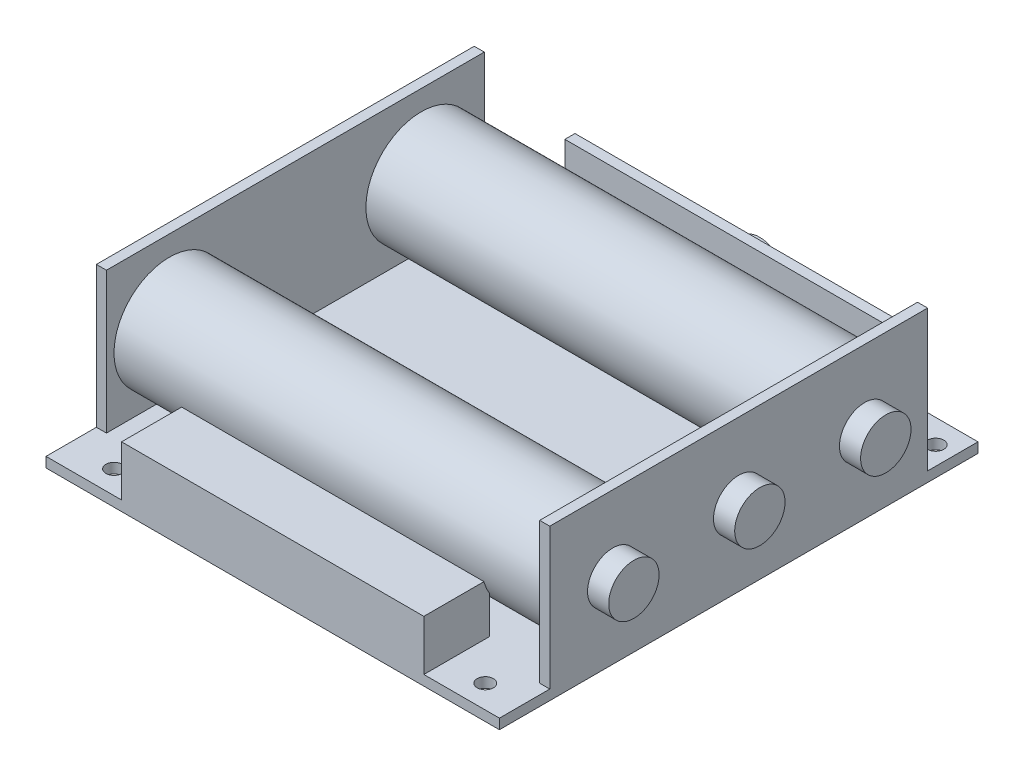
SolidWorks part; units mm, degrees
ref_plane "Front Plane" through (0, 0, 0) normal (0, 0, 1) x (1, 0, 0)
ref_plane "Top Plane" through (0, 0, 0) normal (0, 1, 0) x (1, 0, 0)
ref_plane "Right Plane" through (0, 0, 0) normal (1, 0, 0) x (0, 0, -1)
sketch "Sketch1" plane through (0, 0, 0) normal (0, 1, 0) x (1, 0, 0)
  line L1 (45, 47.5) -> (-45, 47.5)
  line L2 (45, 47.5) -> (45, -47.5)
  line L3 (45, -47.5) -> (-45, -47.5)
  line L4 (-45, 47.5) -> (-45, -47.5)
  line L5 (45, 47.5) -> (-45, -47.5) construction
  line L6 (45, -47.5) -> (-45, 47.5) construction
  point P0 (0, 0)
  dimension "D1" = 90
  dimension "D2" = 95
extrude "Boss-Extrude1" add sketch "Sketch1" along normal blind 2
hole_wizard "Ø3.2 (3.2) Diameter Hole1" positions "Sketch3" profile "Sketch2" hole size "Ø3.2" standard "ISO"
sketch "Sketch3" plane through (0, 0, 0) normal (0, -1, 0) x (-1, 0, 0)
  line L0 (45, 47.5) -> (45, -47.5) construction
  line L2 (45, -47.5) -> (-45, -47.5) construction
  line L3 (-45, -47.5) -> (-45, 47.5) construction
  line L4 (-45, 47.5) -> (45, 47.5) construction
  point P0 (36.1, -42.9)
  point P2 (-37.6, -42.9)
  point P4 (-41.3, 42.8)
  point P6 (38.7, 42.8)
  dimension "D1" = 8.9
  dimension "D2" = 4.6
  dimension "D3" = 7.4
  dimension "D4" = 4.6
  dimension "D5" = 4.7
  dimension "D6" = 3.7
  dimension "D7" = 4.7
  dimension "D8" = 6.3
sketch "Sketch2" plane through (-36.1, 0, 42.9) normal (1, 0, 0) x (0, 0, -1)
  line L0 (0, 0) -> (0, 2)
  line L1 (0, 2) -> (1.6, 2)
  line L2 (1.6, 2) -> (1.6, 0)
  line L5 (1.6, 0) -> (0, 0)
  line L11 (0, -6.35) -> (0, 107.95) construction
  dimension "Thru Hole Dia." = 3.2
  dimension "Thru Hole Depth" = 2
sketch "Sketch4" plane through (45, 0, 0) normal (1, 0, 0) x (0, 0, -1)
  line L0 (-47.5, 0) -> (47.5, 0) construction
  line L1 (-37.5, 0) -> (37.5, 0)
  line L2 (-37.5, 0) -> (-37.5, 30)
  line L3 (-37.5, 30) -> (37.5, 30)
  line L4 (37.5, 0) -> (37.5, 30)
  line L5 (-47.5, 2) -> (-47.5, 0) construction
  line L6 (47.5, 2) -> (47.5, 0) construction
  point P6 (-47.5, 1)
  dimension "D1" = 10
  dimension "D2" = 10
  dimension "D3" = 30
extrude "Boss-Extrude2" add sketch "Sketch4" against normal blind 2
mirror "Mirror1" about plane through (0, 0, 0) normal (1, 0, 0) of "Boss-Extrude2"
sketch "Sketch5" plane through (45, 0, 0) normal (1, 0, 0) x (0, 0, -1)
  line L0 (47.5, 2) -> (47.5, 0) construction
  line L2 (37.5, 30) -> (-37.5, 30) construction
  circle A0 centre (-25, 15) radius 5
  circle A1 centre (25, 15) radius 5
  point P4 (47.5, 1)
  dimension "D1" = 10
  dimension "D2" = 10
  dimension "D3" = 50
  dimension "D4" = 22.5
  dimension "D5" = 15
extrude "Boss-Extrude3" add sketch "Sketch5" along normal blind 4.2 and the other way blind 94.2
surface "Surface-Offset1" parameters "D1"=6
sketch "Sketch6" plane through (0, 2, 0) normal (0, 1, 0) x (1, 0, 0)
  line L0 (-45, -47.5) -> (45, -47.5) construction
  line L1 (-30, -34.5) -> (30, -34.5)
  line L2 (-30, -34.5) -> (-30, -47.5)
  line L3 (-30, -47.5) -> (30, -47.5)
  line L4 (30, -34.5) -> (30, -47.5)
  line L5 (-45, -37.5) -> (-45, -47.5) construction
  line L6 (45, -47.5) -> (45, -37.5) construction
  dimension "D1" = 15
  dimension "D2" = 15
  dimension "D3" = 13
extrude "Boss-Extrude4" add sketch "Sketch6" along normal blind 10
sketch "Sketch7" plane through (-45, 0, 0) normal (-1, 0, 0) x (0, 0, 1)
  line L0 (-37.5, 30) -> (37.5, 30) construction
  circle A0 centre (0, 15) radius 5
  dimension "D1" = 10
  dimension "D2" = 15
extrude "Boss-Extrude5" add sketch "Sketch7" along normal blind 4.2
mirror "Mirror2" about plane through (0, 0, 0) normal (1, 0, 0) of "Boss-Extrude5"
sketch "Sketch8" plane through (0, 0, -47.5) normal (0, 0, -1) x (-1, 0, 0)
  line L0 (-45, 0) -> (45, 0) construction
  line L1 (-35, 0) -> (35, 0)
  line L2 (-35, 0) -> (-35, 15)
  line L3 (-35, 15) -> (35, 15)
  line L4 (35, 0) -> (35, 15)
  line L5 (-45, 2) -> (-45, 0) construction
  line L6 (45, 2) -> (45, 0) construction
  point P6 (-45, 1)
  dimension "D1" = 10
  dimension "D2" = 10
  dimension "D3" = 15
extrude "Boss-Extrude6" add sketch "Sketch8" against normal blind 2
sketch "Sketch9" plane through (0, 0, -47.5) normal (0, 0, -1) x (-1, 0, 0)
  line L4 (-35, 15) -> (-35, 2) construction
  line L5 (-45, 0) -> (45, 0) construction
  circle A2 centre (2.55, 6.3) radius 5
  dimension "D1" = 37.55
  dimension "D2" = 10
  dimension "D3" = 6.3
extrude "Boss-Extrude7" add sketch "Sketch9" along normal blind 4.2
